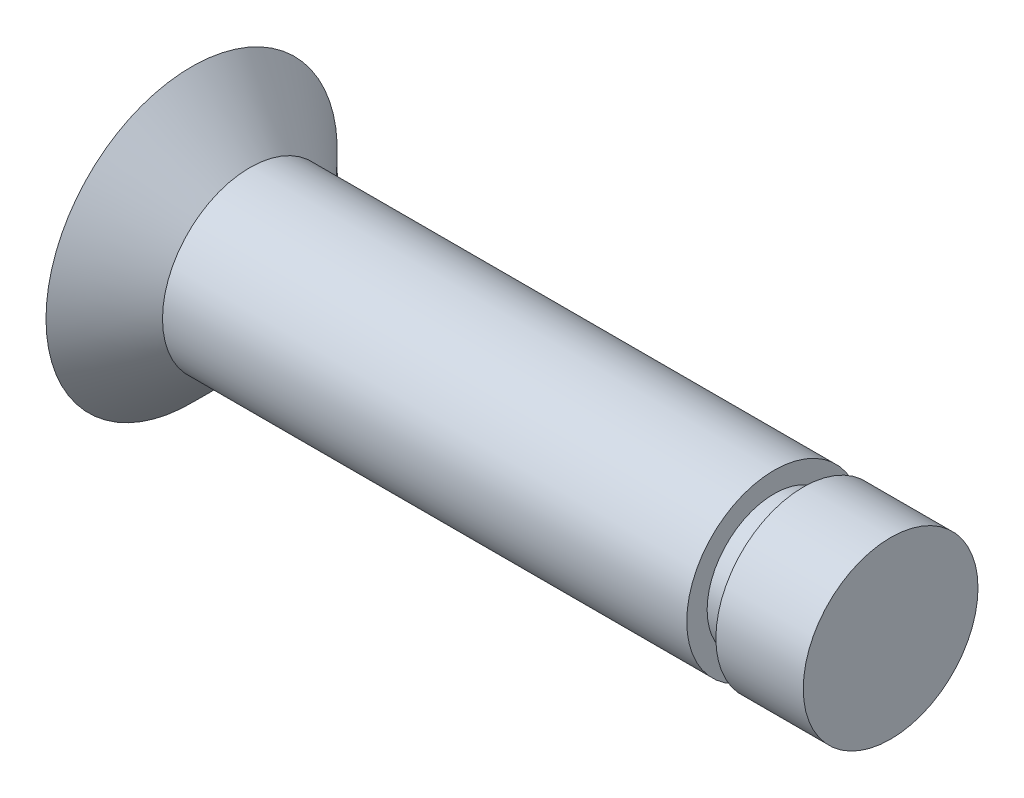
SolidWorks part; units mm, degrees
ref_plane "Plan1" through (0, 0, 0) normal (0, 0, 1) x (1, 0, 0)
ref_plane "Plan2" through (0, 0, 0) normal (0, 1, 0) x (1, 0, 0)
ref_plane "Plan3" through (0, 0, 0) normal (1, 0, 0) x (0, 0, -1)
sketch "Esquisse1" plane through (0, 0, 0) normal (0, 0, 1) x (1, 0, 0)
  line L0 (-40, 0) -> (67, 0) construction
  line L1 (0, 0) -> (0, 2.5)
  line L2 (0, 2.5) -> (1, 1.5)
  line L3 (1, 1.5) -> (10, 1.5)
  line L4 (10, 1.5) -> (10, 1.15)
  line L5 (10, 1.15) -> (10.5, 1.15)
  line L6 (10.5, 1.15) -> (10.5, 1.5)
  line L7 (10.5, 1.5) -> (12, 1.5)
  line L8 (12, 1.5) -> (12, 0)
  line L9 (0, 0) -> (12, 0)
  dimension "D1" = 12
  dimension "D2" = 1
  dimension "D3" = 2.5
  dimension "D4" = 3
  dimension "D5" = 1.5
  dimension "D6" = 0.5
  dimension "D7" = 2.3
revolve "Base-Révolution" add sketch "Esquisse1" angle 360 about L0
